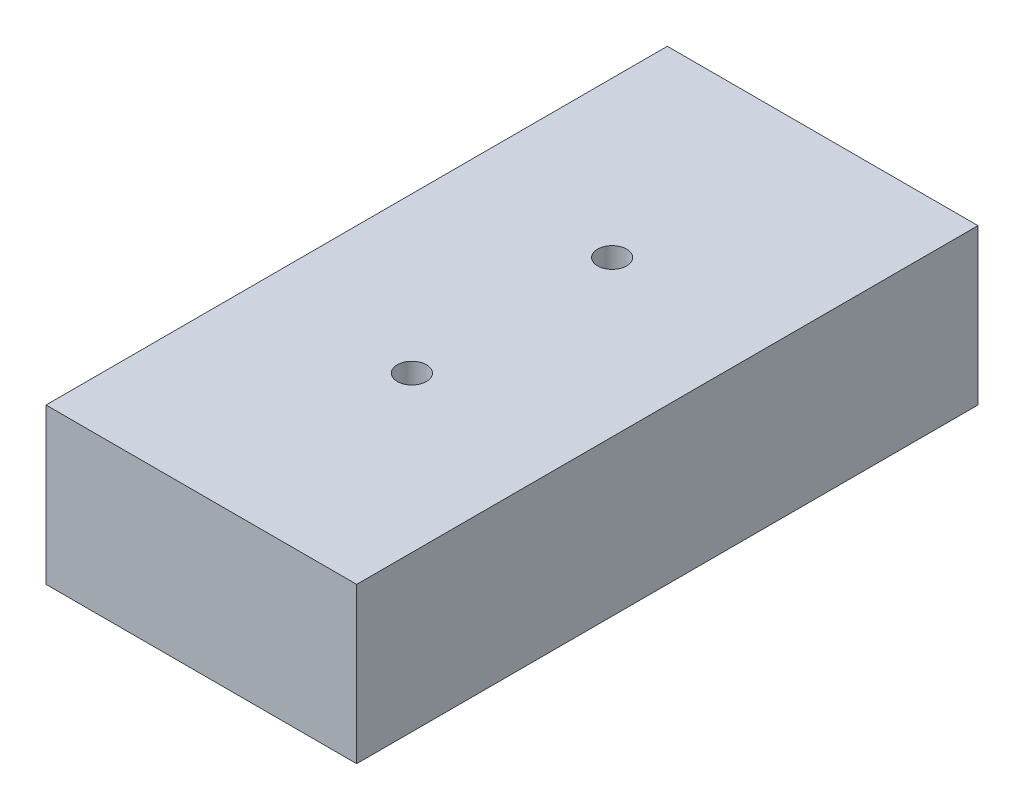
SolidWorks part; units mm, degrees
ref_plane "Front Plane" through (0, 0, 0) normal (0, 0, 1) x (1, 0, 0)
ref_plane "Top Plane" through (0, 0, 0) normal (0, 1, 0) x (1, 0, 0)
ref_plane "Right Plane" through (0, 0, 0) normal (1, 0, 0) x (0, 0, -1)
sketch "Sketch1" plane through (0, 0, 0) normal (0, 0, 1) x (1, 0, 0)
  line L0 (0, 0) -> (0, 25.4) construction
  line L1 (-50.8, -25.4) -> (50.8, -25.4)
  line L2 (-50.8, -25.4) -> (-50.8, 25.4)
  line L3 (-50.8, 25.4) -> (50.8, 25.4)
  line L4 (50.8, -25.4) -> (50.8, 25.4)
  line L5 (0, 0) -> (50.8, 0) construction
  dimension "D1" = 50.8
  dimension "D2" = 101.6
extrude "Extrude1" add sketch "Sketch1" along normal mid plane 203.2
hole_wizard "3/8 (0.375) Diameter Hole1" positions "Sketch3" profile "Sketch2" hole size "3/8" standard "Ansi Inch"
sketch "Sketch3" plane through (0, 25.4, 0) normal (0, 1, 0) x (-1, 0, 0)
  line L0 (0, 0) -> (-28.7228, 0) construction
  point P0 (0, 32.751)
  point P1 (0, -32.751)
sketch "Sketch2" plane through (0, 25.4, 32.751) normal (1, 0, 0) x (0, 0, 1)
  line L0 (0, 0) -> (0, 50.8)
  line L1 (0, 50.8) -> (4.7625, 50.8)
  line L2 (4.7625, 50.8) -> (4.7625, 0)
  line L5 (4.7625, 0) -> (0, 0)
  line L11 (0, -6.35) -> (0, 107.95) construction
  dimension "Thru Hole Dia." = 9.525
  dimension "Thru Hole Depth" = 50.8
